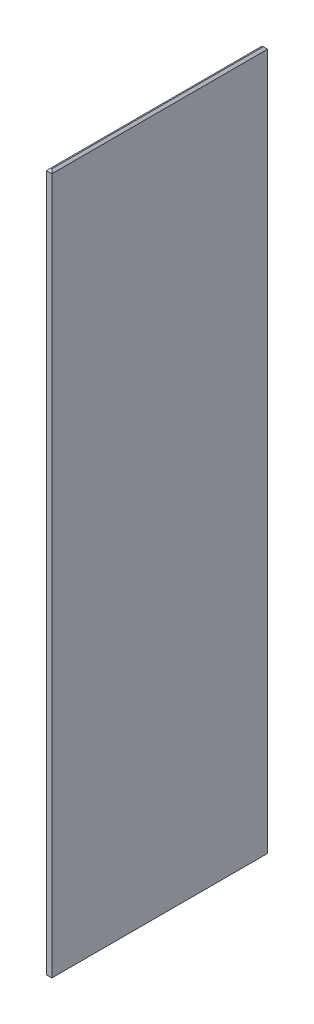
SolidWorks part; units mm, degrees
ref_plane "Front Plane" through (0, 0, 0) normal (1, 0, 0) x (0, 1, 0)
ref_plane "Top Plane" through (0, 0, 0) normal (0, 0, 1) x (0, 1, 0)
ref_plane "Right Plane" through (0, 0, 0) normal (0, 1, 0) x (-1, 0, 0)
sketch "Sketch1" plane through (0, 0, 0) normal (0, 1, 0) x (-1, 0, 0)
  line L1 (-38.1, 1500) -> (38.1, 1500)
  line L2 (-38.1, 1500) -> (-38.1, -1500)
  line L3 (-38.1, -1500) -> (38.1, -1500)
  line L4 (38.1, 1500) -> (38.1, -1500)
  line L5 (-38.1, 1500) -> (38.1, -1500) construction
  line L6 (-38.1, -1500) -> (38.1, 1500) construction
  point P0 (0, 0)
  dimension "D1" = 3000
  dimension "D2" = 76.2
extrude "Boss-Extrude1" add sketch "Sketch1" along normal blind 9739.6
ref_plane "Mating plane" through (0, 0, -1750) normal (0, 0, -1) x (0, 1, 0)
chamfer "Chamfer1" distance 30 angle 45 8 edges at (0, 0, 1500) (38.1, 0, 0) (0, 0, -1500) (-38.1, 0, 0) (0, 9739.6, -1500) (38.1, 9739.6, 0) (0, 9739.6, 1500) (-38.1, 9739.6, 0)
